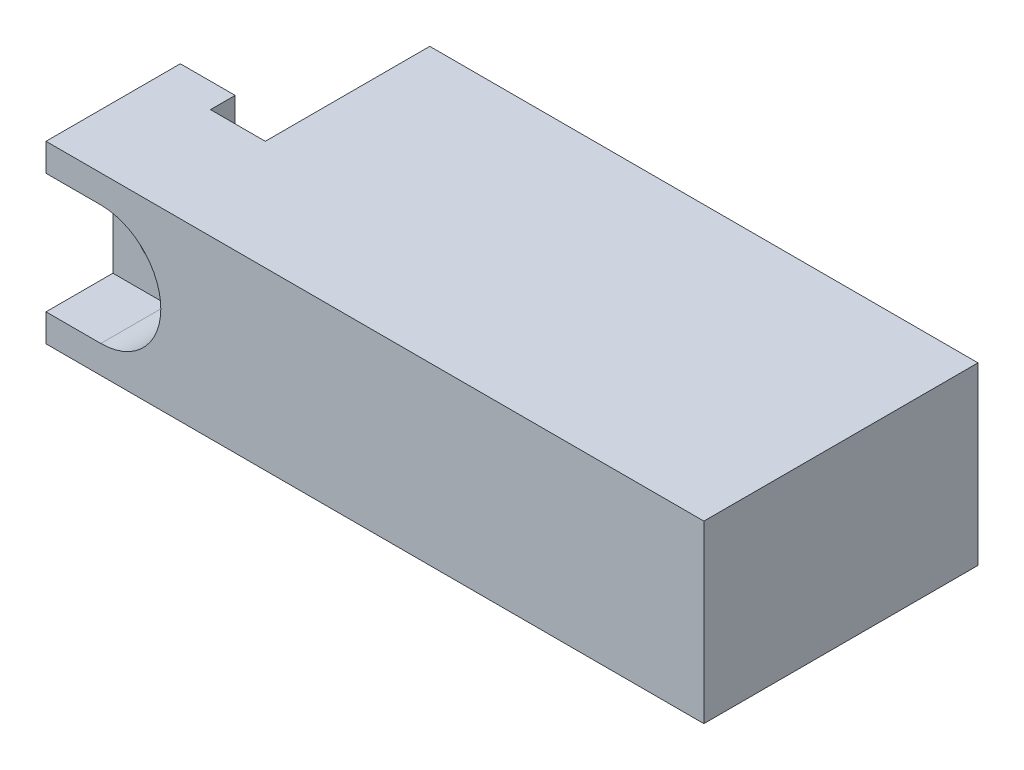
SolidWorks part; units mm, degrees
ref_plane "TOP" through (0, 0, 0) normal (0, 0, 1) x (1, 0, 0)
ref_plane "FRONT" through (0, 0, 0) normal (0, 1, 0) x (1, 0, 0)
ref_plane "RIGHT" through (0, 0, 0) normal (1, 0, 0) x (0, 0, -1)
sketch "Sketch1" plane through (0, 0, 0) normal (0, 1, 0) x (1, 0, 0)
  line L0 (-5.08, 6.35) -> (-5.08, 0)
  line L1 (-5.08, 6.35) -> (-2.54, 6.35)
  line L2 (-2.54, 6.35) -> (-2.54, 5.08)
  line L3 (-2.54, 5.08) -> (0, 5.08)
  line L4 (0, 5.08) -> (0, 12.7)
  line L5 (0, 12.7) -> (25.4, 12.7)
  line L6 (25.4, 12.7) -> (25.4, 0)
  line L7 (-5.08, 0) -> (25.4, 0)
  dimension "D1" = 7.62
  dimension "D2" = 2.54
  dimension "D3" = 2.54
  dimension "D4" = 12.7
  dimension "D5" = 1.27
  dimension "D6" = 25.4
extrude "Extrude1" add sketch "Sketch1" along normal mid plane 8.128
sketch "Sketch2" plane through (0, 0, 0) normal (0, 0, 1) x (1, 0, 0)
  line L0 (-5.08, 4.064) -> (-5.08, -4.064) construction
  point P0 (-2.54, 0)
  dimension "D1" = 2.54
hole_wizard "CBORE for #4 Socket Head Cap Screw1" positions "3DSketch1" profile "Sketch3" counterbore size "#4" standard "Ansi Inch"
sketch3d "3DSketch1"
  point P0 (-2.54, 0, 0)
sketch "Sketch3" plane through (-2.54, 0, 0) normal (1, 0, 0) x (0, -1, 0)
  line L0 (0, 0) -> (0, 12.7)
  line L1 (0, 12.7) -> (1.6319, 12.7)
  line L3 (1.6319, 12.7) -> (1.632, 3.0988)
  line L4 (1.632, 3.0988) -> (2.7788, 3.0988)
  line L5 (2.7788, 3.0988) -> (2.7788, 0)
  line L7 (2.7788, 0) -> (0, 0)
  line L11 (0, -6.35) -> (0, 107.95) construction
  dimension "Thru Hole Dia." = 3.2639
  dimension "Thru Hole Depth" = 12.7
  dimension "C'Bore Dia." = 5.5575
  dimension "C'Bore Depth" = 3.0988
sketch "Sketch4" plane through (0, 0, 0) normal (0, 0, 1) x (1, 0, 0)
  line L0 (-2.54, -4.064) -> (-2.54, -1.6319) construction
  line L1 (-2.54, 2.7788) -> (-5.08, 2.7788)
  line L2 (-2.54, 2.7788) -> (-2.54, -2.7788)
  line L3 (-2.54, -2.7788) -> (-5.08, -2.7788)
  line L4 (-5.08, 2.7788) -> (-5.08, -2.7788)
  line L5 (-5.08, 1.1269) -> (-5.08, 4.064) construction
  arc A0 (-5.08, -1.1269) -> (-5.08, 1.1269) centre (-2.54, 0) ccw construction
extrude "Cut-Extrude1" cut sketch "Sketch4" against normal up to surface (3.0988 mm away)
sketch "Sketch5" plane through (0, 0, -6.35) normal (0, 0, -1) x (-1, 0, 0)
  line L5 (2.54, 4.064) -> (2.54, 1.6319)
  line L6 (2.54, -1.6319) -> (2.54, -4.064)
  line L7 (2.54, -4.064) -> (5.08, -4.064)
  line L8 (5.08, -4.064) -> (5.08, 4.064)
  line L9 (5.08, 4.064) -> (2.54, 4.064)
  line L10 (2.54, 4.064) -> (2.54, 1.6319)
  line L11 (2.54, -1.6319) -> (2.54, -4.064)
  line L12 (2.54, -4.064) -> (5.08, -4.064)
  line L13 (5.08, -4.064) -> (5.08, 4.064)
  line L14 (5.08, 4.064) -> (2.54, 4.064)
  arc A1 (2.54, -1.6319) -> (2.54, 1.6319) centre (2.54, 0) ccw
  arc A2 (2.54, -1.6319) -> (2.54, 1.6319) centre (2.54, 0) ccw
  dimension "D1" = 0
extrude "Cut-Extrude2" cut sketch "Sketch5" against normal blind 0.127
